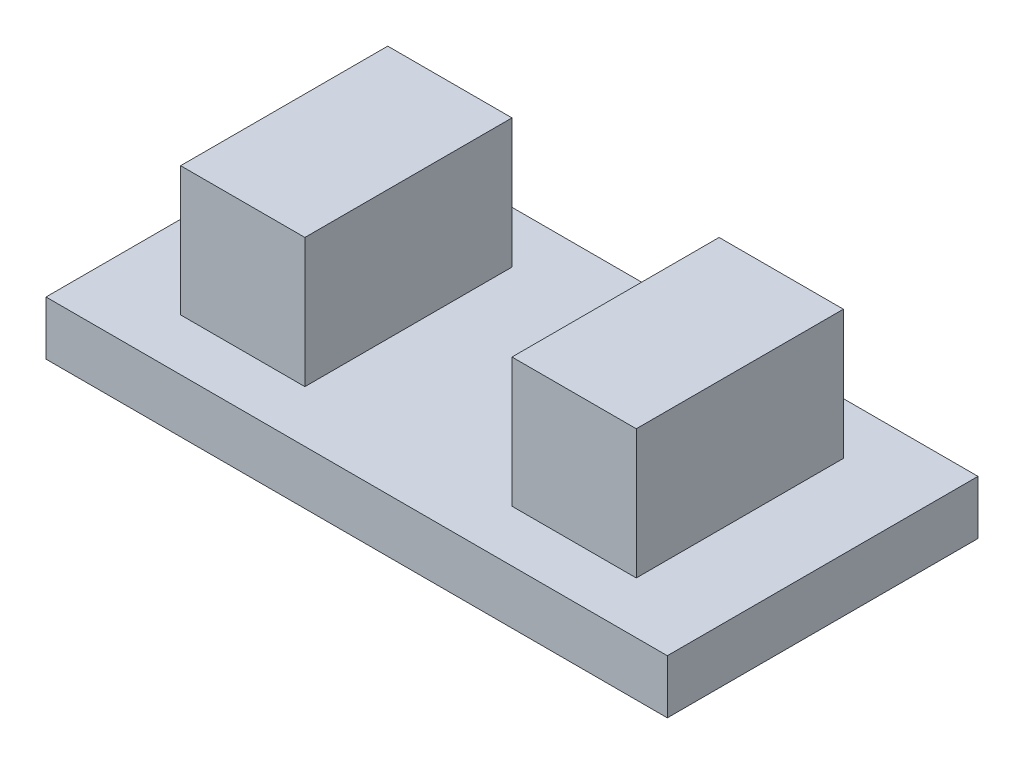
SolidWorks part; units mm, degrees
ref_plane "Front Plane" through (0, 0, 0) normal (0, 0, 1) x (1, 0, 0)
ref_plane "Top Plane" through (0, 0, 0) normal (0, 1, 0) x (1, 0, 0)
ref_plane "Right Plane" through (0, 0, 0) normal (1, 0, 0) x (0, 0, -1)
sketch "Sketch1" plane through (0, 0, 0) normal (0, 1, 0) x (1, 0, 0)
  line L0 (75, -37.5) -> (-75, 37.5) construction
  line L1 (-75, 37.5) -> (75, 37.5)
  line L2 (-75, 37.5) -> (-75, -37.5)
  line L3 (-75, -37.5) -> (75, -37.5)
  line L4 (75, 37.5) -> (75, -37.5)
  dimension "D1" = 150
  dimension "D2" = 75
extrude "Extrude1" add sketch "Sketch1" along normal blind 13
sketch "Sketch2" plane through (0, 13, 0) normal (0, 1, 0) x (1, 0, 0)
  line L0 (0, 0) -> (-25, 0) construction
  line L1 (-55, -25) -> (-25, -25)
  line L2 (-55, -25) -> (-55, 25)
  line L3 (-55, 25) -> (-25, 25)
  line L4 (-25, -25) -> (-25, 25)
  dimension "D1" = 30
  dimension "D2" = 50
  dimension "D3" = 25
extrude "Extrude2" add sketch "Sketch2" along normal blind 31.1991 separate body
mirror "Mirror4" about plane through (0, 0, 0) normal (1, 0, 0)
